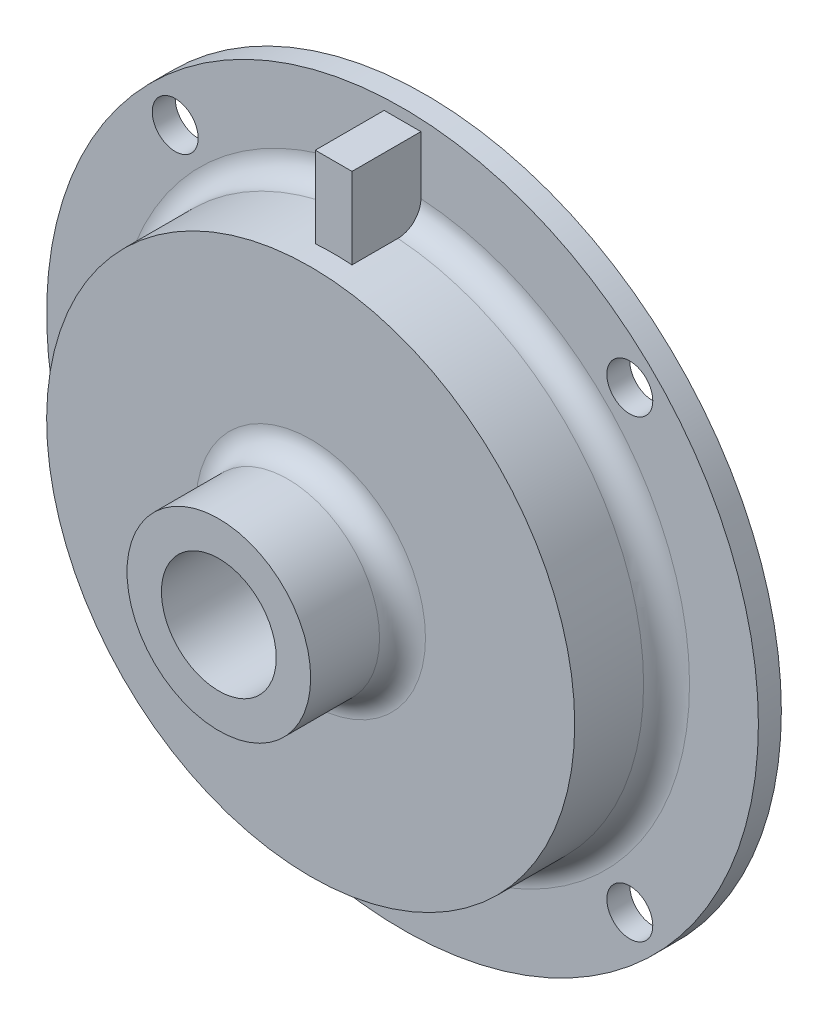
SolidWorks part; units mm, degrees
ref_plane "Front" through (0, 0, 0) normal (0, 0, 1) x (1, 0, 0)
ref_plane "Top" through (0, 0, 0) normal (0, 1, 0) x (1, 0, 0)
ref_plane "Right" through (0, 0, 0) normal (1, 0, 0) x (0, 0, -1)
sketch "Sketch1" plane through (0, 0, 0) normal (0, 0, 1) x (1, 0, 0)
  circle A0 centre (0, 0) radius 49.2125
  dimension "D1" = 98.425
extrude "Base-Extrude" add sketch "Sketch1" along normal blind 3.175
sketch "Sketch5" plane through (0, 0, 3.175) normal (0, 0, 1) x (1, 0, 0)
  line L0 (31.4309, 31.4309) -> (0, 0) construction
  line L1 (0, 0) -> (44.45, 0) construction
  circle A0 centre (0, 0) radius 44.45 construction
  circle A1 centre (31.4309, 31.4309) radius 3.175
  dimension "D1" = 88.9
  dimension "D2" = 6.35
  dimension "D3" = 45
extrude "Cut-Extrude2" cut sketch "Sketch5" against normal through all
pattern_circular "CirPattern1" count 4 every 90 about axis through (0, 0, 0) along (0, 0, 1) of "Cut-Extrude2"
sketch "Sketch2" plane through (0, 0, 3.175) normal (0, 0, 1) x (1, 0, 0)
  circle A0 centre (0, 0) radius 36.5125
  dimension "D1" = 73.025
extrude "Boss-Extrude1" add sketch "Sketch2" along normal blind 12.7
sketch "Sketch3" plane through (0, 0, 15.875) normal (0, 0, 1) x (1, 0, 0)
  circle A0 centre (0, 0) radius 12.7
  dimension "D1" = 25.4
extrude "Boss-Extrude2" add sketch "Sketch3" along normal blind 12.7
fillet "Fillet1" radius 3.175 2 edges at (36.5125, 0, 3.175) (12.7, 0, 15.875)
sketch "Sketch6" plane through (0, 0, 0) normal (0, 1, 0) x (1, 0, 0)
  line L0 (-2.54, -3.175) -> (-2.54, -12.7)
  line L1 (-39.6875, -3.175) -> (39.6875, -3.175) construction
  line L2 (-2.54, -3.175) -> (2.54, -3.175)
  line L3 (-49.2125, -3.175) -> (49.2125, -3.175) construction
  line L4 (2.54, -3.175) -> (2.54, -12.7)
  line L5 (-2.54, -12.7) -> (2.54, -12.7)
  line L6 (0, 0) -> (0, -38.11) construction
  line L7 (0, -3.175) -> (0, 0) construction
  dimension "D1" = 5.08
  dimension "D2" = 9.525
extrude "Boss-Extrude3" add sketch "Sketch6" along normal blind 47.625
sketch "Sketch4" plane through (0, 0, 28.575) normal (0, 0, 1) x (1, 0, 0)
  circle A0 centre (0, 0) radius 7.9375
  dimension "D1" = 15.875
extrude "Cut-Extrude1" cut sketch "Sketch4" against normal through all
fillet "Fillet2" radius 3.175
sketch "Sketch7" plane through (2.54, 0, 0) normal (1, 0, 0) x (0, 0, -1)
  circle A0 centre (-9.525, 44.45) radius 1.5875
  arc A1 (-9.525, 47.625) -> (-12.7, 44.45) centre (-9.525, 44.45) ccw construction
  dimension "D1" = 3.175
extrude "Cut-Extrude3" cut sketch "Sketch7" against normal up to next
fillet "Fillet3" radius 1.5875
